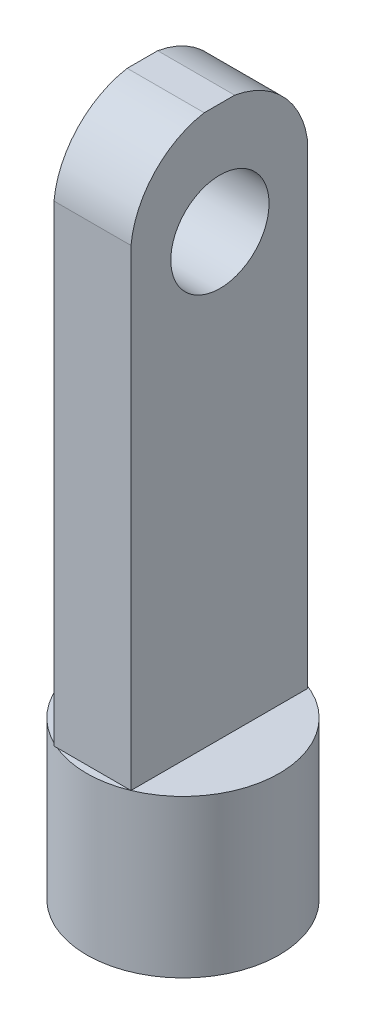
SolidWorks part; units mm, degrees
ref_plane "Front Plane" through (0, 0, 0) normal (0, 0, 1) x (1, 0, 0)
ref_plane "Top Plane" through (0, 0, 0) normal (0, 1, 0) x (1, 0, 0)
ref_plane "Right Plane" through (0, 0, 0) normal (1, 0, 0) x (0, 0, -1)
sketch "Sketch1" plane through (0, 0, 0) normal (0, 1, 0) x (1, 0, 0)
  circle A0 centre (0, 0) radius 6.223
  dimension "D1" = 12.446
extrude "Boss-Extrude1" add sketch "Sketch1" along normal blind 10.16
sketch "Sketch2" plane through (0, 10.16, 0) normal (0, 1, 0) x (1, 0, 0)
  line L1 (-2.5891, 5.6588) -> (2.3868, 5.6588)
  line L2 (-2.5891, 5.6588) -> (-2.5891, -5.7471)
  line L3 (-2.5891, -5.7471) -> (2.3868, -5.7471)
  line L4 (2.3868, 5.6588) -> (2.3868, -5.7471)
  circle A0 centre (0, 0) radius 6.223 construction
extrude "Boss-Extrude2" add sketch "Sketch2" along normal blind 35.56
sketch "Sketch3" plane through (-2.5891, 0, 0) normal (-1, 0, 0) x (0, 0, 1)
  circle A0 centre (0, 38.5532) radius 3.302
  dimension "D1" = 6.604
extrude "Cut-Extrude1" cut sketch "Sketch3" against normal blind 35.56
sketch "Sketch4" plane through (-2.5891, 0, 0) normal (-1, 0, 0) x (0, 0, 1)
  line L0 (-5.7173, 40.1167) -> (-5.6588, 45.72)
  line L1 (-5.6588, 45.72) -> (5.7471, 45.72)
  line L2 (5.7471, 45.72) -> (5.7788, 40.0567)
  circle A0 centre (0.0306, 40.0567) radius 5.7482
extrude "Cut-Extrude3" cut sketch "Sketch4" against normal blind 35.56 contours A0 M4 M5 | A0 M5 M6
sketch "Sketch5" plane through (2.3868, 0, 0) normal (1, 0, 0) x (0, 0, -1)
  circle A0 centre (0, 38.5532) radius 3.175
  circle A1 centre (0, 38.5532) radius 3.302
  dimension "D1" = 6.35
extrude "Boss-Extrude4" add sketch "Sketch5" against normal blind 5.08
sketch "Sketch6" plane through (0, 0, 5.7471) normal (0, 0, 1) x (1, 0, 0)
  line L1 (-2.5891, 34.46) -> (-3.6342, 34.46)
  line L2 (-2.5891, 34.46) -> (-2.5891, 42.7924)
  line L3 (-2.5891, 42.7924) -> (-3.6342, 42.7924)
  line L4 (-3.6342, 34.46) -> (-3.6342, 42.7924)
extrude "Cut-Extrude5" cut sketch "Sketch6" against normal blind 16.764
